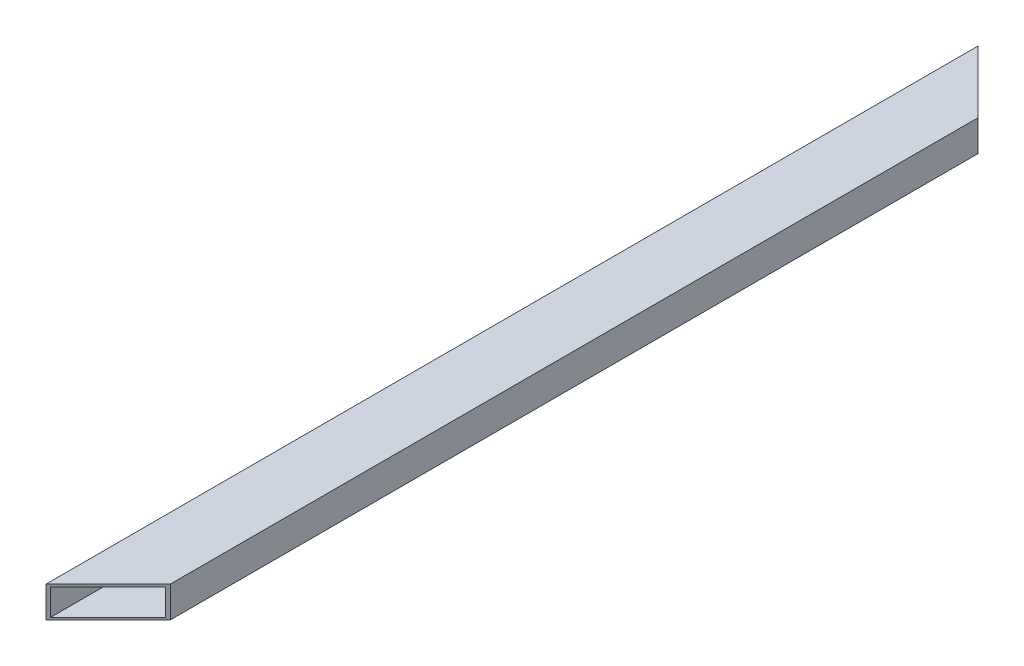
SolidWorks part; units mm, degrees
ref_plane "Plan de face" through (0, 0, 0) normal (0, 0, 1) x (1, 0, 0)
ref_plane "Plan de dessus" through (0, 0, 0) normal (0, 1, 0) x (1, 0, 0)
ref_plane "Plan de droite" through (0, 0, 0) normal (1, 0, 0) x (0, 0, -1)
sketch "Esquisse1" plane through (0, 0, 0) normal (0, 0, 1) x (1, 0, 0)
  line L1 (0, 0) -> (80, 0)
  line L2 (0, 0) -> (0, 40)
  line L3 (0, 40) -> (80, 40)
  line L4 (80, 0) -> (80, 40)
  line L5 (3, 37) -> (77, 37)
  line L6 (3, 37) -> (3, 3)
  line L7 (3, 3) -> (77, 3)
  line L8 (77, 37) -> (77, 3)
  dimension "D1" = 80
  dimension "D2" = 40
  dimension "D3" = 3
  dimension "D4" = 3
  dimension "D5" = 3
  dimension "D6" = 3
extrude "Extrusion1" add sketch "Esquisse1" along normal blind 1200
ref_plane "Plan1" through (0, 0, 600) normal (0, 0, 1) x (1, 0, 0)
chamfer "Chanfrein2" distance 80 1 edges at (80, 20, 1200)
chamfer "Chanfrein3" distance 80 1 edges at (80, 20, 0)
